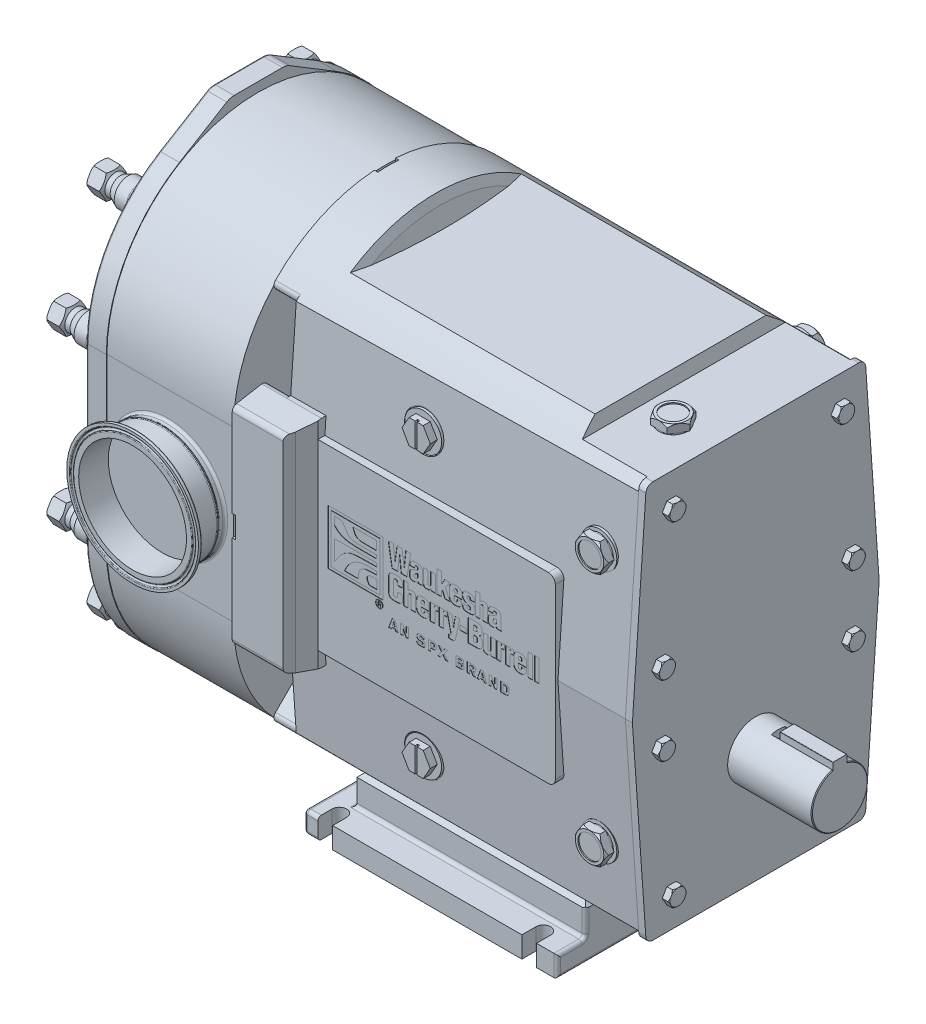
SolidWorks part; units mm, degrees
ref_plane "Front Plane" through (0, 0, 0) normal (0, 0, 1) x (1, 0, 0)
ref_plane "Top Plane" through (0, 0, 0) normal (0, 1, 0) x (1, 0, 0)
ref_plane "Right Plane" through (0, 0, 0) normal (1, 0, 0) x (0, 0, -1)
other "Join1"
other "grease fitting<4>@220_U2_Lower Shaft"
other "grease fitting<2>@220_U2_Lower Shaft"
other "cleanout plug<2>@220_U2_Lower Shaft"
other "oil plug<6>@220_U2_Lower Shaft"
other "oil plug<4>@220_U2_Lower Shaft"
other "108372<8>@220_U2_Lower Shaft"
other "108372<7>@220_U2_Lower Shaft"
other "108372<6>@220_U2_Lower Shaft"
other "108372<4>@220_U2_Lower Shaft"
other "108372<3>@220_U2_Lower Shaft"
other "108372<2>@220_U2_Lower Shaft"
other "Key_220<1>@220_U2_Lower Shaft"
other "Shaft_220<1>@220_U2_Lower Shaft"
other "grease fitting<3>@220_U2_Lower Shaft"
other "grease fitting<1>@220_U2_Lower Shaft"
other "cleanout plug<1>@220_U2_Lower Shaft"
other "oil plug<5>@220_U2_Lower Shaft"
other "oil plug<3>@220_U2_Lower Shaft"
other "oil plug<2>@220_U2_Lower Shaft"
other "oil plug<1>@220_U2_Lower Shaft"
other "plate_220<1>@220_U2_Lower Shaft"
other "108372<5>@220_U2_Lower Shaft"
other "108372<1>@220_U2_Lower Shaft"
other "101851<1>@220_U2_Lower Shaft"
other "220001000S<1>@220_U2_Lower Shaft"
other "230110000<1>@220_U2_Lower Shaft"
other "230005000<1>@220_U2_Lower Shaft"
other "220360009<2>@220_U2_Lower Shaft"
other "220360009<1>@220_U2_Lower Shaft"
